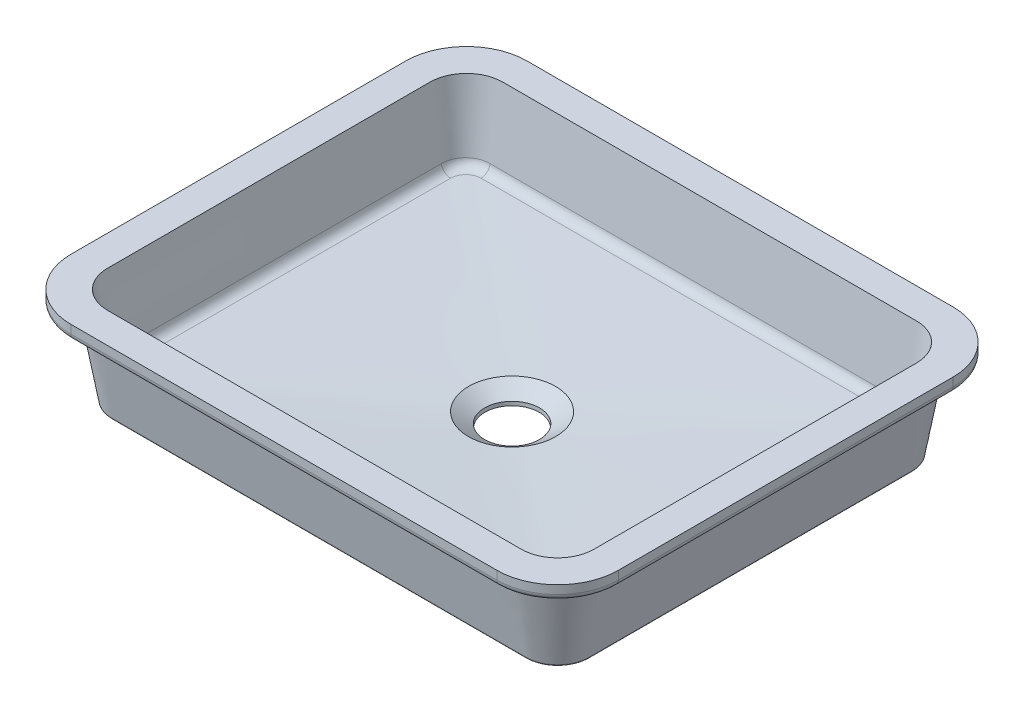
SolidWorks part; units mm, degrees
ref_plane "Front Plane" through (0, 0, 0) normal (0, 0, 1) x (1, 0, 0)
ref_plane "Top Plane" through (0, 0, 0) normal (0, 1, 0) x (1, 0, 0)
ref_plane "Right Plane" through (0, 0, 0) normal (1, 0, 0) x (0, 0, -1)
sketch "Sketch1" plane through (0, 0, 0) normal (0, 1, 0) x (1, 0, 0)
  line L0 (-163.9822, 151.1572) -> (163.7107, 151.1572)
  line L1 (188.7107, 126.1572) -> (188.7107, -126.1572)
  line L2 (163.7107, -151.1572) -> (-163.9822, -151.1572)
  line L3 (-188.9822, -126.1572) -> (-188.9822, 126.1572)
  line L4 (225, 137.5) -> (225, -137.5)
  line L5 (-225, 137.5) -> (-225, -137.5)
  line L6 (175, -187.5) -> (-175, -187.5)
  line L7 (170, 162.5) -> (-170, 162.5)
  line L8 (175, 187.5) -> (-175, 187.5)
  line L9 (200, 132.5) -> (200, -132.5)
  line L10 (170, -162.5) -> (-170, -162.5)
  line L11 (-200, 132.5) -> (-200, -132.5)
  circle A0 centre (0, 0) radius 37.225
  circle A1 centre (0, 0) radius 22.5
  arc A2 (188.7107, 126.1572) -> (163.7107, 151.1572) centre (163.7107, 126.1572) ccw
  arc A3 (163.7107, -151.1572) -> (188.7107, -126.1572) centre (163.7107, -126.1572) ccw
  arc A4 (-188.9822, -126.1572) -> (-163.9822, -151.1572) centre (-163.9822, -126.1572) ccw
  arc A5 (-163.9822, 151.1572) -> (-188.9822, 126.1572) centre (-163.9822, 126.1572) ccw
  arc A6 (175, -187.5) -> (225, -137.5) centre (175, -137.5) ccw
  arc A7 (-175, 187.5) -> (-225, 137.5) centre (-175, 137.5) ccw
  arc A8 (-225, -137.5) -> (-175, -187.5) centre (-175, -137.5) ccw
  arc A9 (170, -162.5) -> (200, -132.5) centre (170, -132.5) ccw
  arc A10 (-200, -132.5) -> (-170, -162.5) centre (-170, -132.5) ccw
  arc A11 (-170, 162.5) -> (-200, 132.5) centre (-170, 132.5) ccw
  arc A12 (225, 137.5) -> (175, 187.5) centre (175, 137.5) ccw
  arc A13 (200, 132.5) -> (170, 162.5) centre (170, 132.5) ccw
  dimension "D3" = 375
  dimension "D4" = 325
sketch "Sketch2" plane through (0, 0, 0) normal (0, 0, 1) x (1, 0, 0)
  line L33 (-200.1591, 0) -> (-189.728, -60.2292)
  line L34 (-181.1433, -79.9544) -> (-175.5209, -70.683)
  line L35 (-0.1591, 0) -> (0.0462, -79.9544) construction
  line L36 (224.8409, 0) -> (-225.1591, 0)
  line L37 (-200.1591, 0) -> (-225.1591, 0)
  line L38 (-35.725, -68.248) -> (-185.6062, -60.3594)
  line L39 (-210.3261, 0) -> (-196.1433, -79.9544)
  line L40 (-181.1433, -79.9544) -> (-196.1433, -79.9544)
  line L41 (-208.1975, -12) -> (-225.1591, -12)
  line L42 (-225.1591, 0) -> (-225.1591, -12)
  line L43 (-35.999, -79.9544) -> (-181.1433, -79.9544)
  line L44 (-35.725, -68.248) -> (35.725, -68.248)
  line L45 (-22.4944, -76.9088) -> (22.4944, -76.9088)
  line L46 (22.4944, -76.9088) -> (22.4305, -79.9544)
  line L47 (35.725, -68.248) -> (22.4944, -76.9088)
  line L48 (-35.725, -68.248) -> (-22.4944, -76.9088)
  line L49 (-22.4944, -76.9088) -> (-22.3027, -79.9544)
  line L50 (-22.4944, -76.9088) -> (22.4944, -76.9088)
  line L51 (-22.3027, -79.9544) -> (22.4305, -79.9544)
  line L52 (-35.999, -79.9544) -> (-22.3027, -79.9544)
  line L53 (199.8409, 0) -> (189.4097, -60.2292)
  line L54 (209.9853, 0) -> (195.9529, -79.9544)
  line L55 (35.999, -79.9544) -> (180.825, -79.9544)
  line L56 (199.8409, 0) -> (224.8409, 0)
  line L57 (207.8792, -12) -> (224.8409, -12)
  line L58 (35.725, -68.248) -> (185.288, -60.3594)
  line L59 (180.825, -79.9544) -> (195.9529, -79.9544)
  line L60 (224.8409, 0) -> (224.8409, -12)
  line L61 (35.999, -79.9544) -> (22.4305, -79.9544)
  line L62 (-36.0407, -78.243) -> (-35.999, -79.9544)
  line L63 (180.825, -79.9544) -> (175.2027, -70.683)
  line L64 (36.0407, -78.243) -> (35.999, -79.9544)
  line L65 (36.0407, -78.243) -> (175.2027, -70.683)
  line L66 (-36.0407, -78.243) -> (-175.5209, -70.683)
  arc A2 (-190.4208, -56.2289) -> (-185.6062, -60.3594) centre (-185.4968, -55.3606) ccw
  arc A3 (185.288, -60.3594) -> (190.1025, -56.2289) centre (185.1785, -55.3606) ccw
  point P14 (0, 0)
sketch "Sketch3" plane through (0, 0, 0) normal (1, 0, 0) x (0, 0, -1)
  line L3 (-36.3948, -78.2243) -> (-138.1814, -71.21)
  line L4 (36.4304, -78.2243) -> (138.1815, -71.2103)
  line L6 (-36.3948, -78.2243) -> (-152.7563, -70.2056) construction
  line L7 (36.4304, -78.2243) -> (152.7565, -70.2056) construction
  line L32 (-162.5, 0) -> (-152.0688, -60.2292)
  line L33 (-172.667, 0) -> (-158.4842, -79.9544)
  line L34 (162.5, 0) -> (-162.5, 0)
  line L35 (-162.5, 0) -> (-187.5, 0)
  line L36 (-170.5383, -12) -> (-187.5, -12)
  line L37 (158.612, -79.9544) -> (-158.4842, -79.9544)
  line L38 (-187.5, 0) -> (-187.5, -12)
  line L39 (162.5, 0) -> (152.0688, -60.2292)
  line L40 (172.6444, 0) -> (158.612, -79.9544)
  line L41 (170.5383, -12) -> (187.5, -12)
  line L42 (187.5, 0) -> (187.5, -12)
  line L43 (162.5, 0) -> (187.5, 0)
  line L44 (-22.3027, -79.9544) -> (22.4305, -79.9544)
  line L45 (143.4842, -79.9544) -> (138.1815, -71.2103)
  line L46 (-143.4842, -79.9544) -> (-138.1814, -71.21)
  line L48 (-35.7073, -68.248) -> (-152.0688, -60.2292)
  line L50 (-35.7073, -68.248) -> (35.7427, -68.248)
  line L51 (-22.4767, -76.9088) -> (22.5122, -76.9088)
  line L52 (22.5122, -76.9088) -> (22.4482, -79.9544)
  line L53 (35.7427, -68.248) -> (22.5122, -76.9088)
  line L54 (-35.7073, -68.248) -> (-22.4767, -76.9088)
  line L55 (-22.4767, -76.9088) -> (-22.2849, -79.9544)
  line L56 (-22.4767, -76.9088) -> (22.5122, -76.9088)
  line L57 (35.7427, -68.248) -> (152.0688, -60.2292)
  line L59 (-36.023, -78.243) -> (-35.9813, -79.9544)
  line L60 (36.0585, -78.243) -> (36.0167, -79.9544)
  dimension "D1" = 10
  dimension "D2" = 10
sketch "Sketch4" plane through (0, 0, 0) normal (0, 1, 0) x (1, 0, 0)
  line L0 (225, 137.5) -> (225, -137.5) construction
  line L1 (175, -187.5) -> (-175, -187.5) construction
  line L2 (-225, 137.5) -> (-225, -137.5) construction
  line L3 (175, 187.5) -> (-175, 187.5) construction
  line L4 (225, 137.5) -> (225, -137.5)
  line L5 (175, -187.5) -> (-175, -187.5)
  line L6 (-225, 137.5) -> (-225, -137.5)
  line L7 (175, 187.5) -> (-175, 187.5)
  arc A0 (225, 137.5) -> (175, 187.5) centre (175, 137.5) ccw construction
  arc A1 (175, -187.5) -> (225, -137.5) centre (175, -137.5) ccw construction
  arc A2 (-225, -137.5) -> (-175, -187.5) centre (-175, -137.5) ccw construction
  arc A3 (-175, 187.5) -> (-225, 137.5) centre (-175, 137.5) ccw construction
  arc A4 (225, 137.5) -> (175, 187.5) centre (175, 137.5) ccw
  arc A5 (175, -187.5) -> (225, -137.5) centre (175, -137.5) ccw
  arc A6 (-225, -137.5) -> (-175, -187.5) centre (-175, -137.5) ccw
  arc A7 (-175, 187.5) -> (-225, 137.5) centre (-175, 137.5) ccw
extrude "Extrude1" add sketch "Sketch4" against normal up to vertex
sketch "Sketch5" plane through (0, 0, 0) normal (0, 1, 0) x (1, 0, 0)
  line L8 (-170, -172.5) -> (170, -172.5)
  line L9 (210, -132.5) -> (210, 132.5)
  line L10 (170, 172.5) -> (-170, 172.5)
  line L11 (-210, 132.5) -> (-210, -132.5)
  line L12 (-170, -172.5) -> (170, -172.5)
  line L13 (210, -132.5) -> (210, 132.5)
  line L14 (170, 172.5) -> (-170, 172.5)
  line L15 (-210, 132.5) -> (-210, -132.5)
  arc A8 (-210, -132.5) -> (-170, -172.5) centre (-170, -132.5) ccw
  arc A9 (170, -172.5) -> (210, -132.5) centre (170, -132.5) ccw
  arc A10 (210, 132.5) -> (170, 172.5) centre (170, 132.5) ccw
  arc A11 (-170, 172.5) -> (-210, 132.5) centre (-170, 132.5) ccw
  arc A12 (-210, -132.5) -> (-170, -172.5) centre (-170, -132.5) ccw
  arc A13 (170, -172.5) -> (210, -132.5) centre (170, -132.5) ccw
  arc A14 (210, 132.5) -> (170, 172.5) centre (170, 132.5) ccw
  arc A15 (-170, 172.5) -> (-210, 132.5) centre (-170, 132.5) ccw
  dimension "D1" = 10
ref_plane "Plane6" through (0, -79.9544, 0) normal (0, 1, 0) x (-1, 0, 0)
sketch "Sketch6" plane through (0, -79.9544, 0) normal (0, 1, 0) x (-1, 0, 0)
  line L3 (-170, 162.5) -> (170, 162.5) construction
  line L5 (-200, -132.5) -> (-200, 132.5) construction
  line L10 (-170, -162.5) -> (170, -162.5) construction
  line L11 (200, -132.5) -> (200, 132.5) construction
  line L18 (-169.8634, -158.612) -> (169.8634, -158.612)
  line L19 (196.1433, -132.3321) -> (196.1433, 132.3321)
  line L20 (169.9913, 158.4842) -> (-169.9913, 158.4842)
  line L21 (-195.9529, 132.5225) -> (-195.9529, -132.5225)
  arc A12 (-195.9529, -132.5225) -> (-169.8634, -158.612) centre (-169.8634, -132.5225) ccw
  arc A13 (169.8634, -158.612) -> (196.1433, -132.3321) centre (169.8634, -132.3321) ccw
  arc A14 (196.1433, 132.3321) -> (169.9913, 158.4842) centre (169.9913, 132.3321) ccw
  arc A15 (-169.9913, 158.4842) -> (-195.9529, 132.5225) centre (-169.9913, 132.5225) ccw
  dimension "D1" = 25.9616
loft "Loft1" add profiles "Sketch6", "Sketch5"
sketch "Sketch7" plane through (0, 0, 0) normal (0, 1, 0) x (1, 0, 0)
  line L0 (200, 132.5) -> (200, -132.5) construction
  line L1 (170, -162.5) -> (-170, -162.5) construction
  line L2 (-200, 132.5) -> (-200, -132.5) construction
  line L3 (170, 162.5) -> (-170, 162.5) construction
  line L4 (200, 132.5) -> (200, -132.5)
  line L5 (170, -162.5) -> (-170, -162.5)
  line L6 (-200, 132.5) -> (-200, -132.5)
  line L7 (170, 162.5) -> (-170, 162.5)
  arc A0 (200, 132.5) -> (170, 162.5) centre (170, 132.5) ccw construction
  arc A1 (170, -162.5) -> (200, -132.5) centre (170, -132.5) ccw construction
  arc A2 (-200, -132.5) -> (-170, -162.5) centre (-170, -132.5) ccw construction
  arc A3 (-170, 162.5) -> (-200, 132.5) centre (-170, 132.5) ccw construction
  arc A4 (200, 132.5) -> (170, 162.5) centre (170, 132.5) ccw
  arc A5 (170, -162.5) -> (200, -132.5) centre (170, -132.5) ccw
  arc A6 (-200, -132.5) -> (-170, -162.5) centre (-170, -132.5) ccw
  arc A7 (-170, 162.5) -> (-200, 132.5) centre (-170, 132.5) ccw
ref_plane "Plane7" through (0, -60.2292, 0) normal (0, 1, 0) x (-1, 0, 0)
sketch "Sketch8" plane through (0, -60.2292, 0) normal (0, 1, 0) x (-1, 0, 0)
  line L0 (35.725, 0) -> (190.1025, 0) construction
  line L1 (-35.725, 0) -> (-190.1025, 0) construction
  line L2 (0, -35.7427) -> (0, -152.0688) construction
  line L3 (0, 35.7073) -> (0, 152.0688) construction
  line L12 (-171.1025, 152.0688) -> (171.1025, 152.0688)
  line L13 (190.1025, -133.0688) -> (190.1025, 133.0688)
  line L14 (-190.1025, 133.0688) -> (-190.1025, -133.0688)
  line L15 (-171.1025, -152.0688) -> (171.1025, -152.0688)
  arc A5 (-190.1025, 133.0688) -> (-171.1025, 152.0688) centre (-171.1025, 133.0688) cw
  arc A6 (190.1025, 133.0688) -> (171.1025, 152.0688) centre (171.1025, 133.0688) ccw
  arc A7 (171.1025, -152.0688) -> (190.1025, -133.0688) centre (171.1025, -133.0688) ccw
  arc A8 (-190.1025, -133.0688) -> (-171.1025, -152.0688) centre (-171.1025, -133.0688) ccw
  dimension "D1" = 19
loft "Cut-Loft1" cut profiles "Sketch7", "Sketch8"
sketch "Sketch9" plane through (0, -79.9544, 0) normal (0, 1, 0) x (-1, 0, 0)
  line L6 (22.3027, 0) -> (-22.4305, 0) construction
  line L7 (170.325, -143.4842) -> (-170.325, -143.4842)
  line L9 (180.825, -132.9842) -> (180.825, 132.9842)
  line L10 (170.325, 143.4842) -> (-170.325, 143.4842)
  line L11 (-180.825, -132.9842) -> (-180.825, 132.9842)
  arc A1 (-180.825, 132.9842) -> (-170.325, 143.4842) centre (-170.325, 132.9842) cw
  arc A2 (180.825, 132.9842) -> (170.325, 143.4842) centre (170.325, 132.9842) ccw
  arc A3 (170.325, -143.4842) -> (180.825, -132.9842) centre (170.325, -132.9842) ccw
  arc A4 (-180.825, -132.9842) -> (-170.325, -143.4842) centre (-170.325, -132.9842) ccw
  point P7 (-0.0639, 0)
  dimension "D1" = 10.5
extrude "Extrude2" cut sketch "Sketch9" along normal up to vertex draft 30
sketch "Sketch10" plane through (0, -70.683, 0) normal (0, -1, 0) x (1, 0, 0)
  line L4 (170.325, 138.1313) -> (-170.325, 138.1313)
  line L5 (-175.4722, 132.9842) -> (-175.4722, -132.9842)
  line L6 (-170.325, -138.1313) -> (170.325, -138.1313)
  line L7 (175.4722, -132.9842) -> (175.4722, 132.9842)
  line L8 (170.325, 138.1313) -> (-170.325, 138.1313)
  line L9 (-175.4722, 132.9842) -> (-175.4722, -132.9842)
  line L10 (-170.325, -138.1313) -> (170.325, -138.1313)
  line L11 (175.4722, -132.9842) -> (175.4722, 132.9842)
  arc A4 (175.4722, 132.9842) -> (170.325, 138.1313) centre (170.325, 132.9842) ccw
  arc A5 (-170.325, 138.1313) -> (-175.4722, 132.9842) centre (-170.325, 132.9842) ccw
  arc A6 (-175.4722, -132.9842) -> (-170.325, -138.1313) centre (-170.325, -132.9842) ccw
  arc A7 (170.325, -138.1313) -> (175.4722, -132.9842) centre (170.325, -132.9842) ccw
  arc A8 (175.4722, 132.9842) -> (170.325, 138.1313) centre (170.325, 132.9842) ccw
  arc A9 (-170.325, 138.1313) -> (-175.4722, 132.9842) centre (-170.325, 132.9842) ccw
  arc A10 (-175.4722, -132.9842) -> (-170.325, -138.1313) centre (-170.325, -132.9842) ccw
  arc A11 (170.325, -138.1313) -> (175.4722, -132.9842) centre (170.325, -132.9842) ccw
  dimension "D1" = 0
ref_plane "Plane8" through (0, -78.243, 0) normal (0, 1, 0) x (-1, 0, 0)
sketch "Sketch12" plane through (0, -78.243, 0) normal (0, 1, 0) x (-1, 0, 0)
  circle A0 centre (0, 0) radius 36.0407
loft "Loft2" add profiles "Sketch10", "Sketch12"
sketch "Sketch13" plane through (0, 0, 0) normal (0, 0, 1) x (1, 0, 0)
  line L0 (-22.3027, -79.9544) -> (22.4305, -79.9544) construction
  line L1 (-36.0407, -78.243) -> (-35.999, -79.9544) construction
  line L2 (-35.999, -79.9544) -> (0, -79.9544)
  line L3 (-36.1498, -73.7699) -> (-35.999, -79.9544)
  line L5 (-36.1498, -73.7699) -> (0, -73.7699)
  line L6 (0, -73.7699) -> (0, -79.9544)
  line L7 (0, -79.9544) -> (0, 0) construction
revolve "Revolve1" add sketch "Sketch13" angle 360 about L7
sketch "Sketch14" plane through (0, -60.2292, 0) normal (0, 1, 0) x (1, 0, 0)
  line L2 (171.1025, 152.0688) -> (-171.1025, 152.0688)
  line L3 (171.1025, 152.0688) -> (-171.1025, 152.0688)
  line L4 (-190.1025, 133.0688) -> (-190.1025, -133.0688)
  line L5 (-190.1025, 133.0688) -> (-190.1025, -133.0688)
  line L8 (-171.1025, -152.0688) -> (171.1025, -152.0688)
  line L9 (-171.1025, -152.0688) -> (171.1025, -152.0688)
  line L10 (190.1025, -133.0688) -> (190.1025, 133.0688)
  line L11 (190.1025, -133.0688) -> (190.1025, 133.0688)
  arc A4 (190.1025, 133.0688) -> (171.1025, 152.0688) centre (171.1025, 133.0688) ccw
  arc A5 (190.1025, 133.0688) -> (171.1025, 152.0688) centre (171.1025, 133.0688) ccw
  arc A6 (-171.1025, 152.0688) -> (-190.1025, 133.0688) centre (-171.1025, 133.0688) ccw
  arc A7 (-171.1025, 152.0688) -> (-190.1025, 133.0688) centre (-171.1025, 133.0688) ccw
  arc A8 (-190.1025, -133.0688) -> (-171.1025, -152.0688) centre (-171.1025, -133.0688) ccw
  arc A9 (-190.1025, -133.0688) -> (-171.1025, -152.0688) centre (-171.1025, -133.0688) ccw
  arc A10 (171.1025, -152.0688) -> (190.1025, -133.0688) centre (171.1025, -133.0688) ccw
  arc A11 (171.1025, -152.0688) -> (190.1025, -133.0688) centre (171.1025, -133.0688) ccw
  dimension "D1" = 0
ref_plane "Plane9" through (0, -68.248, 0) normal (0, 1, 0) x (-1, 0, 0)
sketch "Sketch15" plane through (0, -68.248, 0) normal (0, 1, 0) x (-1, 0, 0)
  line L0 (35.725, 0) -> (-35.725, 0) construction
  circle A0 centre (0, 0) radius 35.725
loft "Cut-Loft2" cut profiles "Sketch14", "Sketch15"
sketch "Sketch16" plane through (0, 0, 0) normal (0, 0, 1) x (1, 0, 0)
  line L1 (-22.4944, -76.9088) -> (-22.3027, -79.9544) construction
  line L2 (-35.725, -68.248) -> (-22.4944, -76.9088) construction
  line L3 (-40.6688, -65.0117) -> (0.0514, -65.0117)
  line L4 (-22.4944, -76.9088) -> (-22.1757, -81.9701)
  line L5 (-40.6688, -65.0117) -> (-22.4944, -76.9088)
  line L7 (-22.1757, -81.9701) -> (0.0514, -81.9701)
  line L9 (0.0514, -65.0117) -> (0.0514, -81.9701)
  line L11 (0.0514, -81.9701) -> (0.0514, -53.1556) construction
revolve "Cut-Revolve2" cut sketch "Sketch16" angle 360 about L11
fillet "Fillet1" radius 8 8 edges
fillet "Fillet2" radius 2 1 edges
fillet "Fillet3" radius 5 8 edges at (-173.5504, -70.683, -136.9955) (0, -70.683, -138.1313) (174.3363, -70.683, -136.2096) (175.4722, -70.683, 0) (173.5504, -70.683, 136.9955) (0, -70.683, 138.1313) (-174.3363, -70.683, 136.2096) (-175.4722, -70.683, 0)
fillet "Fillet4" radius 1.5 16 edges at (177.7497, -79.9544, 140.4088) (180.825, -79.9544, 0) (177.7497, -79.9544, -140.4088) (0, -79.9544, -143.4842) (-177.7497, -79.9544, -140.4088) (-180.825, -79.9544, 0) (-177.7497, -79.9544, 140.4088) (0, -79.9544, 143.4842)
fillet "Fillet5" radius 1.5 1 edges at (0, -79.9544, -35.999)
fillet "Fillet6" radius 5 8 edges at (-210.3553, -12, 172.8553) (-225, -12, 0) (-210.3553, -12, -172.8553) (0, -12, -187.5) (210.3553, -12, -172.8553) (225, -12, 0) (210.3553, -12, 172.8553) (0, -12, 187.5)
